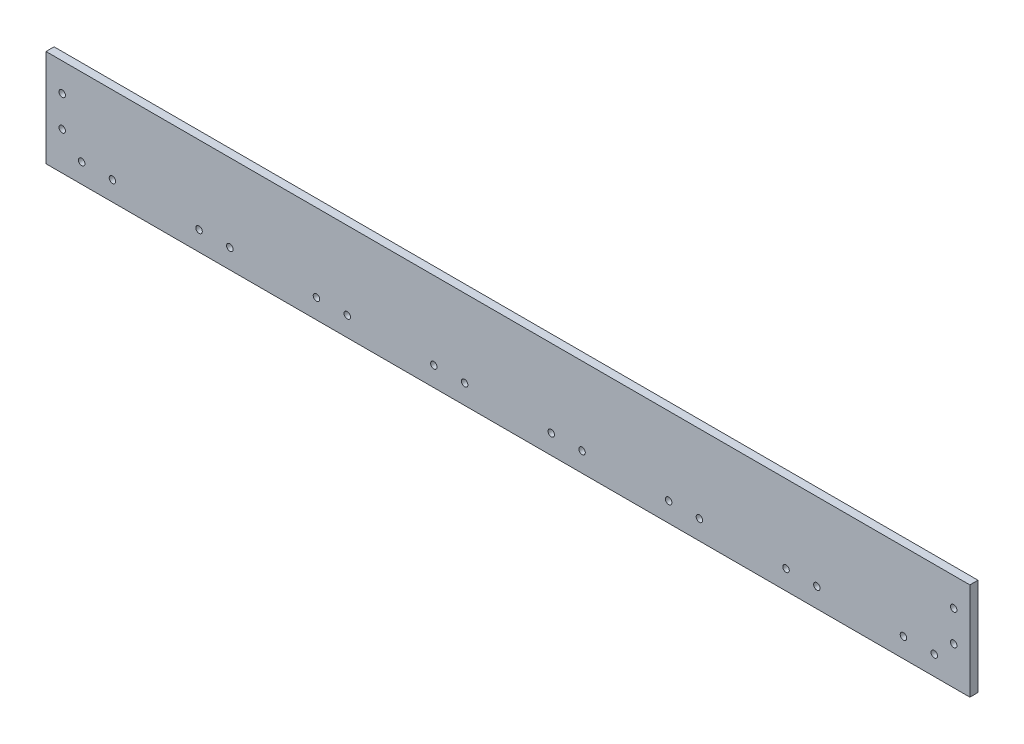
SolidWorks part; units mm, degrees
ref_plane "Front Plane" through (0, 0, 0) normal (0, 0, 1) x (1, 0, 0)
ref_plane "Top Plane" through (0, 0, 0) normal (0, 1, 0) x (1, 0, 0)
ref_plane "Right Plane" through (0, 0, 0) normal (1, 0, 0) x (0, 0, -1)
sketch "Sketch1" plane through (0, 0, 0) normal (0, 0, 1) x (1, 0, 0)
  line L1 (0, 0) -> (723.9, 0)
  line L2 (0, 0) -> (0, 76.2)
  line L3 (0, 76.2) -> (723.9, 76.2)
  line L4 (723.9, 0) -> (723.9, 76.2)
extrude "Boss-Extrude1" add sketch "Sketch1" along normal blind 6.35
sketch "Sketch2" plane through (0, 0, 6.35) normal (0, 0, 1) x (1, 0, 0)
  line L0 (27.94, 0) -> (27.94, 12.7) construction
  line L2 (0, 15.24) -> (25.4, 15.24) construction
  line L3 (0, 76.2) -> (0, 0) construction
  line L4 (0, 0) -> (723.9, 0) construction
  line L5 (30.48, 15.24) -> (49.53, 15.24) construction
  circle A0 centre (27.94, 15.24) radius 2.54
  circle A1 centre (52.07, 15.24) radius 2.54
  point P13 (1219.2, 76.2)
extrude "Cut-Extrude1" cut sketch "Sketch2" against normal up to surface (6.35 mm away) contours A1 | A0
sketch "Sketch3" plane through (0, 0, 6.35) normal (0, 0, 1) x (1, 0, 0)
  line L0 (0, 76.2) -> (0, 0) construction
  line L1 (723.9, 76.2) -> (0, 76.2) construction
  line L2 (12.7, 41.91) -> (0, 41.91) construction
  line L3 (12.7, 51.435) -> (12.7, 32.385) construction
  line L4 (0, 41.91) -> (0, 38.1) construction
  line L5 (361.95, 76.2) -> (361.95, 0) construction
  line L6 (0, 0) -> (723.9, 0) construction
  circle A0 centre (12.7, 29.845) radius 2.54
  circle A1 centre (12.7, 53.975) radius 2.54
  circle A2 centre (711.2, 29.845) radius 2.54
  circle A3 centre (711.2, 53.975) radius 2.54
  point P13 (0, 38.1)
  point P15 (361.95, 76.2)
  point P17 (12.7, 41.91)
  point P27 (12.7, 41.91)
extrude "Cut-Extrude2" cut sketch "Sketch3" against normal up to surface (6.35 mm away)
pattern_linear "LPattern2" count 8 spacing 91.9843 along (1, 0, 0) of "Cut-Extrude1"
equation "\"vertical-component-width\"= \"railing-width\" - \"railing-padding\""
equation "\"vertical-component-height\"= 3in"
equation "\"material-thickness\"= .25in"
equation "\"D1@Sketch1\"=\"vertical-component-height\""
equation "\"D2@Sketch1\"=\"vertical-component-width\""
equation "\"D1@Boss-Extrude1\"=\"material-thickness\""
equation "\"mounting-hole-diameter\"= .2"
equation "\"mounting-hole-pair-left-to-mount-edge-left\"= 1in"
equation "\"mounting-hole-bottom-to-mount-edge-bottom\"= .5in"
equation "\"mounting-hole-pair-distance-between-holes\"= .75in"
equation "\"distance-between-mounting-hole-pairs\"= ( \"vertical-component-width\" - 2 * \"mounting-hole-pair-left-to-mount-edge-left\" - \"num-mounting-hole-pairs\" * ( 2 * \"mounting-hole-diameter\" + \"mounting-hole-pa"
equation "\"num-mounting-hole-pairs\" = 8"
equation "\"D3@Sketch2\"=\"mounting-hole-pair-distance-between-holes\""
equation "\"D5@Sketch2\"=\"mounting-hole-bottom-to-mount-edge-bottom\""
equation "\"D4@Sketch2\"=\"mounting-hole-pair-left-to-mount-edge-left\""
equation "\"D3@LPattern2\"=\"mounting-hole-pair-left-to-next-mounting-hole-pair-left\""
equation "\"D2@Sketch2\"=\"mounting-hole-diameter\""
equation "\"D1@Sketch2\"=\"mounting-hole-diameter\""
equation "\"mounting-hole-pair-left-to-next-mounting-hole-pair-left\"= \"distance-between-mounting-hole-pairs\" + 2 * \"mounting-hole-diameter\" + \"mounting-hole-pair-distance-between-holes\""
equation "\"edge-mounting-hole-pair-inset\"=0.5"
equation "\"D4@Sketch3\"=\"edge-mounting-hole-pair-inset\""
equation "\"edge-mounting-hole-pair-offset-from-mount-vertical-center\"= 0.15"
equation "\"D5@Sketch3\"=\"edge-mounting-hole-pair-offset-from-mount-vertical-center\""
equation "\"D3@Sketch3\"=\"mounting-hole-pair-distance-between-holes\""
equation "\"railing-width\" = 29in"
equation "\"railing-padding\"= .5in"
equation "\"D1@LPattern2\"=\"num-mounting-hole-pairs\""
